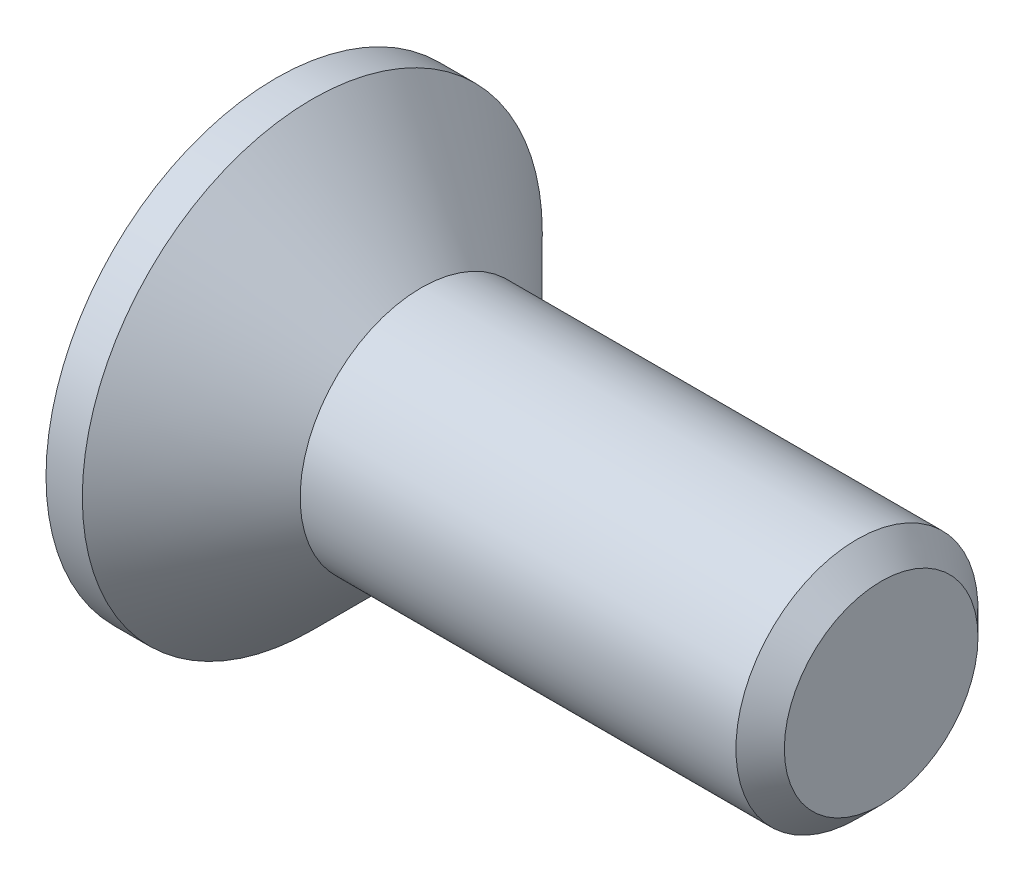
SolidWorks part; units mm, degrees
ref_plane "Front Plane" through (0, 0, 0) normal (0, 0, 1) x (1, 0, 0)
ref_plane "Top Plane" through (0, 0, 0) normal (0, 1, 0) x (1, 0, 0)
ref_plane "Right Plane" through (0, 0, 0) normal (1, 0, 0) x (0, 0, -1)
sketch "Sketch1" plane through (0, 0, 0) normal (0, 0, 1) x (1, 0, 0)
  line L1 (-1.2, 1.9) -> (-1.2, 0)
  line L2 (-1.2, 0) -> (3.8, 0)
  line L3 (3.8, 0) -> (3.8, 1)
  line L4 (3.8, 1) -> (0, 1)
  line L5 (-1.2, 1.9) -> (-0.9, 1.9)
  line L6 (-0.9, 1.9) -> (0, 1)
  dimension "D1" = 1
  dimension "D2" = 45
  dimension "D3" = 1.2
  dimension "D4" = 5
  dimension "D5" = 1.9
revolve "Revolve1" add sketch "Sketch1" angle 360 about L2
chamfer "Chamfer1" distance 0.2 angle 45 1 edges at (3.8, -1, 0)
sketch "Sketch2" plane through (-1.2, 0, 0) normal (-1, 0, 0) x (0, 0, 1)
  line L0 (-0.3, 1.175) -> (0.3, 1.175)
  line L1 (0.3, 1.175) -> (0.3, 0.3)
  line L2 (0.3, 0.3) -> (1.175, 0.3)
  line L3 (1.175, 0.3) -> (1.175, -0.3)
  line L4 (1.175, -0.3) -> (0.3, -0.3)
  line L5 (0.3, -0.3) -> (0.3, -1.175)
  line L6 (0.3, -1.175) -> (-0.3, -1.175)
  line L7 (-0.3, -1.175) -> (-0.3, -0.3)
  line L8 (-0.3, -0.3) -> (-1.175, -0.3)
  line L9 (-1.175, -0.3) -> (-1.175, 0.3)
  line L10 (-1.175, 0.3) -> (-0.3, 0.3)
  line L11 (-0.3, 0.3) -> (-0.3, 1.175)
  point P5 (0, 1.175)
  point P13 (1.175, 0)
  point P15 (-1.175, 0)
  point P16 (0, -1.175)
  point P17 (0.3, 1.085)
  dimension "D1" = 0.6
  dimension "D2" = 2.35
extrude "Cut-Extrude1" cut sketch "Sketch2" against normal blind 0.95
